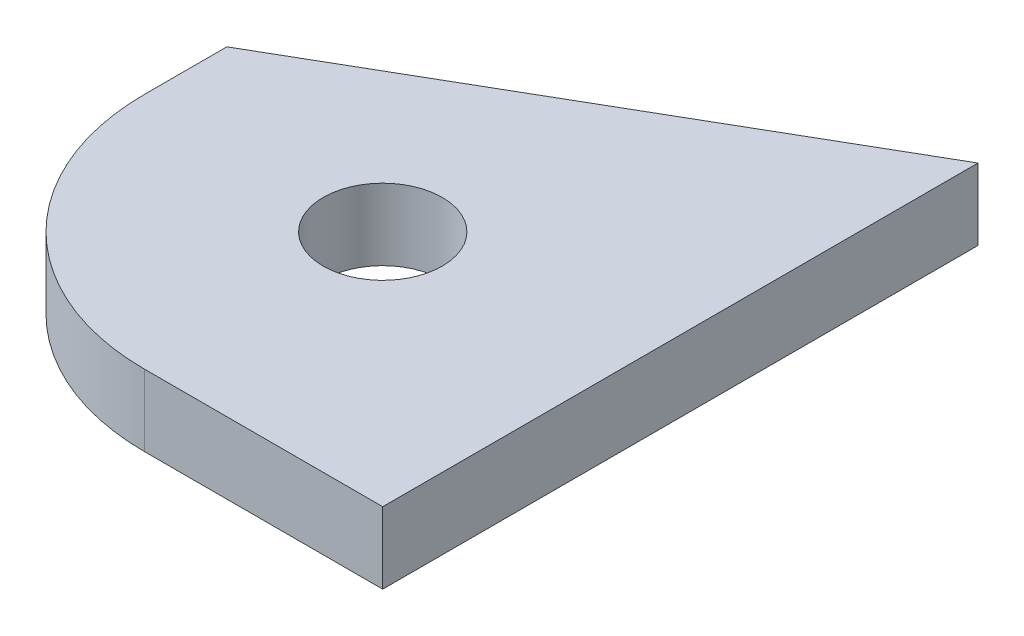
SolidWorks part; units mm, degrees
ref_plane "Front" through (0, 0, 0) normal (0, 0, 1) x (1, 0, 0)
ref_plane "Top" through (0, 0, 0) normal (0, 1, 0) x (1, 0, 0)
ref_plane "Right" through (0, 0, 0) normal (1, 0, 0) x (0, 0, -1)
sketch "Sketch1" plane through (0, 0, 0) normal (0, 1, 0) x (1, 0, 0)
  line L0 (0, 0) -> (0, -25)
  line L1 (0, -25) -> (-10, -25)
  line L3 (0, 0) -> (-20, -11.547)
  line L4 (-20, -15) -> (-20, -11.547)
  arc A0 (-20, -15) -> (-10, -25) centre (-10, -15) ccw
  circle A1 centre (-10, -15) radius 2.5
extrude "Extrude1" add sketch "Sketch1" along normal blind 3
